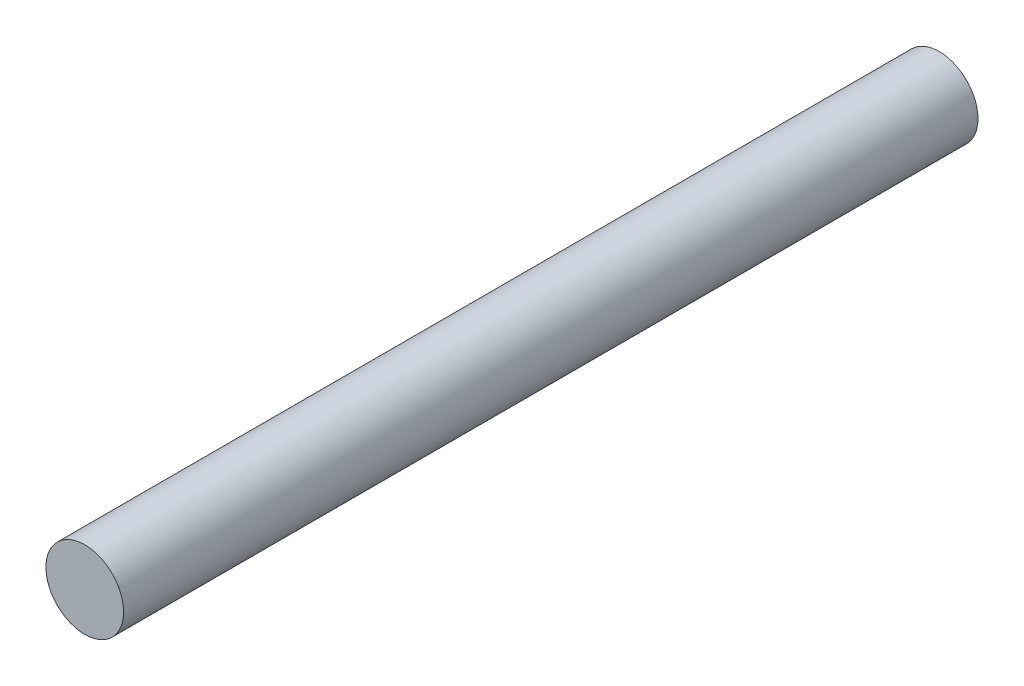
SolidWorks part; units mm, degrees
ref_plane "Front Plane" through (0, 0, 0) normal (0, 0, 1) x (1, 0, 0)
ref_plane "Top Plane" through (0, 0, 0) normal (0, 1, 0) x (1, 0, 0)
ref_plane "Right Plane" through (0, 0, 0) normal (1, 0, 0) x (0, 0, -1)
sketch "Sketch1" plane through (0, 0, 0) normal (0, 0, 1) x (1, 0, 0)
  circle A0 centre (0, 0) radius 1
  dimension "D1" = 2
extrude "Boss-Extrude1" add sketch "Sketch1" along normal blind 22
